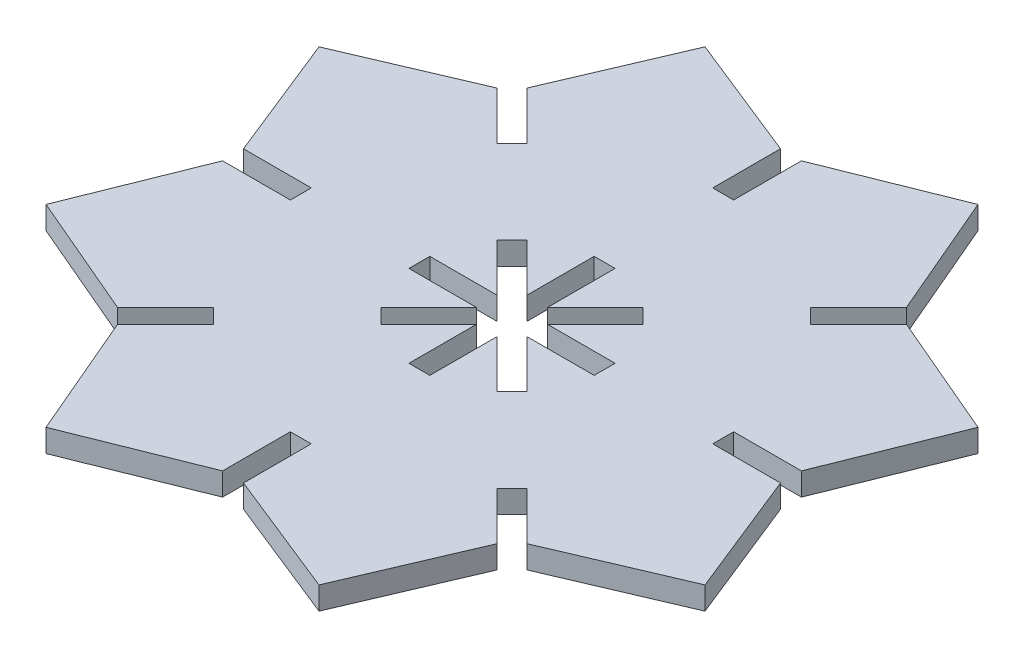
SolidWorks part; units mm, degrees
ref_plane "Alzado" through (0, 0, 0) normal (0, 0, 1) x (1, 0, 0)
ref_plane "Planta" through (0, 0, 0) normal (0, 1, 0) x (1, 0, 0)
ref_plane "Vista lateral" through (0, 0, 0) normal (1, 0, 0) x (0, 0, -1)
sketch "Croquis1" plane through (0, 0, 0) normal (0, 1, 0) x (1, 0, 0)
  line L0 (-16, 36.6197) -> (-1.15, 30.6634) construction
  line L1 (-1.15, 30.6634) -> (-1.15, 23.2114) construction
  line L2 (-1.15, 23.2114) -> (1.15, 23.2114) construction
  line L3 (1.15, 23.2114) -> (1.15, 30.6634) construction
  line L4 (1.15, 30.6634) -> (16, 36.6197) construction
  line L5 (16, 36.6197) -> (29.0824, 27.4083) construction
  line L6 (-16, 36.6197) -> (-29.0824, 27.4083) construction
  line L7 (0, 23.2114) -> (0, 0) construction
  line L8 (-16, 36.6197) -> (16, 36.6197) construction
  line L9 (-29.0824, 27.4083) -> (-29.0824, 103.2114) construction
  line L10 (-29.0824, 103.2114) -> (29.0824, 103.2114) construction
  line L11 (29.0824, 103.2114) -> (29.0824, 27.4083) construction
  circle A0 centre (0, 0) radius 39.9625
  circle A1 centre (0, 0) radius 2.9625
extrude "Saliente-Extruir1" add sketch "Croquis1" along normal mid plane 2.5 contours A0
sketch "Croquis2" plane through (0, 1.25, 0) normal (0, 1, 0) x (1, 0, 0)
  line L0 (-29.0824, 103.2114) -> (29.0824, 103.2114) construction
  line L1 (-1.15, 23.2114) -> (1.15, 23.2114) construction
  line L2 (-29.0824, 27.4083) -> (-29.0824, 103.2114) construction
  line L3 (-16, 36.6197) -> (-29.0824, 27.4083) construction
  line L4 (-16, 36.6197) -> (-1.15, 30.6634) construction
  line L5 (-1.15, 30.6634) -> (-1.15, 23.2114) construction
  line L6 (1.15, 23.2114) -> (1.15, 30.6634) construction
  line L7 (1.15, 30.6634) -> (16, 36.6197) construction
  line L8 (16, 36.6197) -> (29.0824, 27.4083) construction
  line L9 (29.0824, 103.2114) -> (29.0824, 27.4083) construction
  line L10 (-29.0824, 103.2114) -> (29.0824, 103.2114)
  line L11 (-1.15, 23.2114) -> (1.15, 23.2114)
  line L12 (-29.0824, 27.4083) -> (-29.0824, 103.2114)
  line L13 (-16, 36.6197) -> (-29.0824, 27.4083)
  line L14 (-16, 36.6197) -> (-1.15, 30.6634)
  line L15 (-1.15, 30.6634) -> (-1.15, 23.2114)
  line L16 (1.15, 23.2114) -> (1.15, 30.6634)
  line L17 (1.15, 30.6634) -> (16, 36.6197)
  line L18 (16, 36.6197) -> (29.0824, 27.4083)
  line L19 (29.0824, 103.2114) -> (29.0824, 27.4083)
  line L20 (-1.15, 2.7302) -> (-1.15, 10.1822)
  line L21 (-1.15, 10.1822) -> (1.15, 10.1822)
  line L22 (1.15, 10.1822) -> (1.15, 2.7302)
  circle A1 centre (0, 0) radius 2.9625 construction
  arc A2 (-1.15, 2.7302) -> (1.15, 2.7302) centre (0, 0) cw
extrude "Cortar-Extruir2" cut sketch "Croquis2" against normal through all and the other way through all
pattern_circular "MatrizC1" count 8 over 360 about axis through (0, 0, 0) along (0, 1, 0) of "Cortar-Extruir2"
equation "\"Diameter\"= 80"
equation "\"Kerf\"= 0.15"
equation "\"D3@Croquis1\"=\"Diameter\"*0.4"
equation "\"Thickness\"= 2.5"
equation "\"N_Sides\"= 8"
equation "\"D2@Croquis1\"=\"Diameter\" / 6+\"Kerf\"/2"
equation "\"D7@Croquis1\"=\"Diameter\""
equation "\"D1@Saliente-Extruir1\"=\"Thickness\""
equation "\"D1@MatrizC1\"=\"N_Sides\""
equation "\"D4@Croquis1\"=\"Thickness\" -\"Kerf\" - 0.05"
equation "\"D_Hole\"= 6"
equation "\"D8@Croquis1\"=\"D_Hole\"-\"Kerf\"/2"
equation "\"D1@Croquis1\"=\"Diameter\"-\"Kerf\"/2"
equation "\"D5@Croquis1\"=\"D3@Croquis1\"/2"
